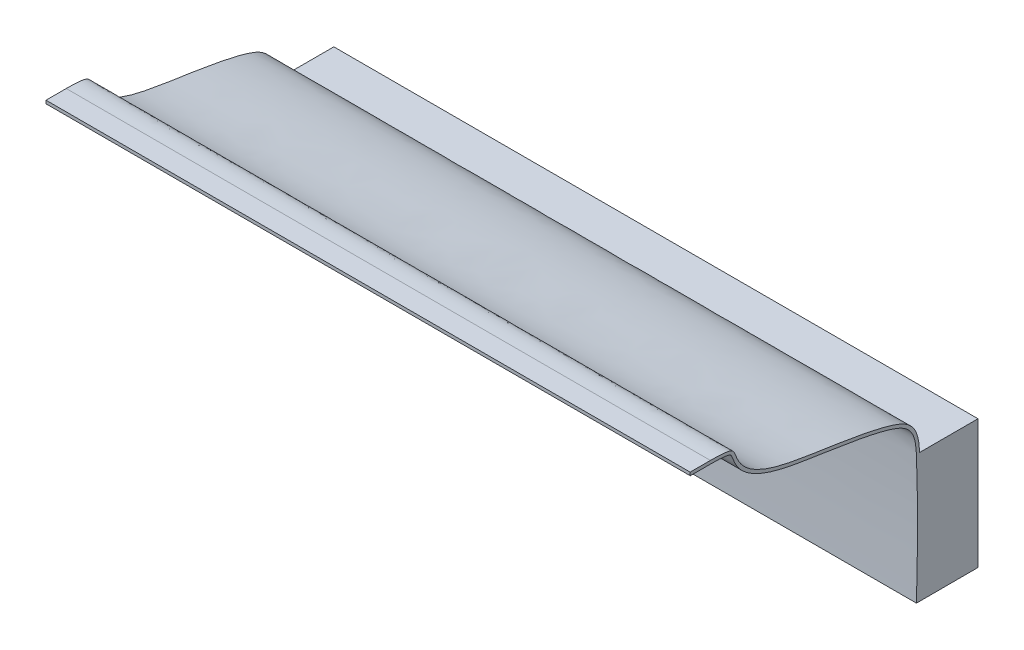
SolidWorks part; units mm, degrees
ref_plane "Front Plane" through (0, 0, 0) normal (0, 0, 1) x (1, 0, 0)
ref_plane "Top Plane" through (0, 0, 0) normal (0, 1, 0) x (1, 0, 0)
ref_plane "Right Plane" through (0, 0, 0) normal (1, 0, 0) x (0, 0, -1)
sketch "Sketch1" plane through (0, 0, 0) normal (0, 1, 0) x (1, 0, 0)
  line L1 (-20.332, 2.3) -> (5.068, 2.3)
  line L2 (-20.332, 2.3) -> (-20.332, 0)
  line L3 (-20.332, 0) -> (5.068, 0)
  line L4 (5.068, 2.3) -> (5.068, 0)
  dimension "D1" = 2.3
  dimension "D2" = 25.4
extrude "Extrude1" add sketch "Sketch1" along normal blind 5.08
sketch "Sketch2" plane through (0, 0, 0) normal (0, -1, 0) x (1, 0, 0)
  line L1 (5.068, 0) -> (-20.332, 0)
  line L2 (5.068, 0) -> (5.068, 0.127)
  line L3 (5.068, 0.127) -> (-20.332, 0.127)
  line L4 (-20.332, 0) -> (-20.332, 0.127)
  dimension "D1" = 0.127
sketch "Sketch3" plane through (-20.332, 0, 0) normal (-1, 0, 0) x (0, 0, 1)
  line L0 (-5.0999, 8.89) -> (8.3711, 8.89) construction
  line L1 (-2.3, 5.08) -> (0, 5.08) construction
  line L2 (8.2468, 8.89) -> (9.0441, 8.89)
  spline S0 degree 3 poles (0.0427, -0.0089) (0.0048, 1.5475) (-0.0332, 3.1039) (0.0801, 6.0398) (0.5592, 6.4647) (2.9902, 6.9339) (6.9917, 7.4662) (7.2165, 8.5031) (7.4347, 8.8893) (8.2468, 8.89) knots 0 0 0 0 0.366492 0.366492 0.546972 0.641931 0.725421 0.934792 1 1 1 1
  dimension "D1" = 3.81
sweep "Sweep1" add profiles "Sketch2" path "Sketch3"
